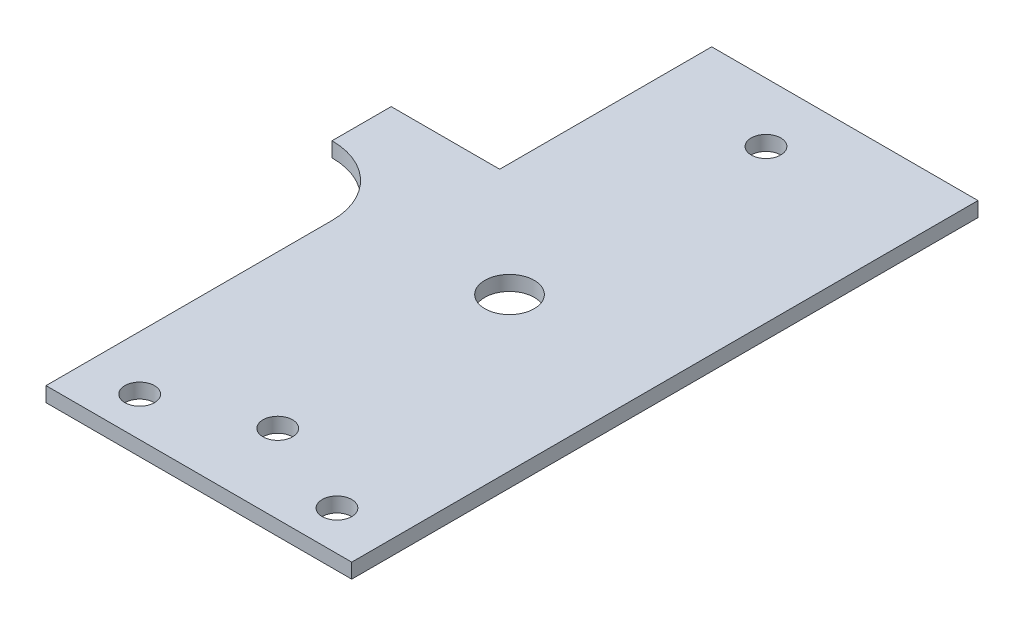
SolidWorks part; units mm, degrees
ref_plane "Front Plane" through (0, 0, 0) normal (0, 0, 1) x (1, 0, 0)
ref_plane "Top Plane" through (0, 0, 0) normal (0, 1, 0) x (1, 0, 0)
ref_plane "Right Plane" through (0, 0, 0) normal (1, 0, 0) x (0, 0, -1)
sketch "Sketch1" plane through (0, 0, 0) normal (0, 1, 0) x (1, 0, 0)
  line L0 (8, 127) -> (8, 84)
  line L1 (0, 0) -> (62, 0)
  line L2 (0, 0) -> (0, 58)
  line L3 (8, 127) -> (62, 127)
  line L4 (62, 0) -> (62, 127)
  line L5 (8, 84) -> (-14, 84)
  line L6 (-14, 84) -> (-14, 72)
  line L7 (31, 0) -> (31, 127) construction
  line L8 (0, 8) -> (62, 8) construction
  arc A0 (0, 58) -> (-14, 72) centre (-14, 58) ccw
  circle A1 centre (31, 16) radius 3
  circle A2 centre (51, 8) radius 3
  circle A3 centre (11, 8) radius 3
  circle A4 centre (31, 115) radius 3
  circle A5 centre (31, 63) radius 5
  dimension "D1" = 11
  dimension "D2" = 11
  dimension "D3" = 20
  dimension "D4" = 31
  dimension "D5" = 6
  dimension "D6" = 10
  dimension "D7" = 14
  dimension "D8" = 8
  dimension "D9" = 8
  dimension "D10" = 47
  dimension "D13" = 21
  dimension "D11" = 12
  dimension "D12" = 43
  dimension "D14" = 31
  dimension "D16" = 23
extrude "Extrude1" add sketch "Sketch1" along normal blind 3
